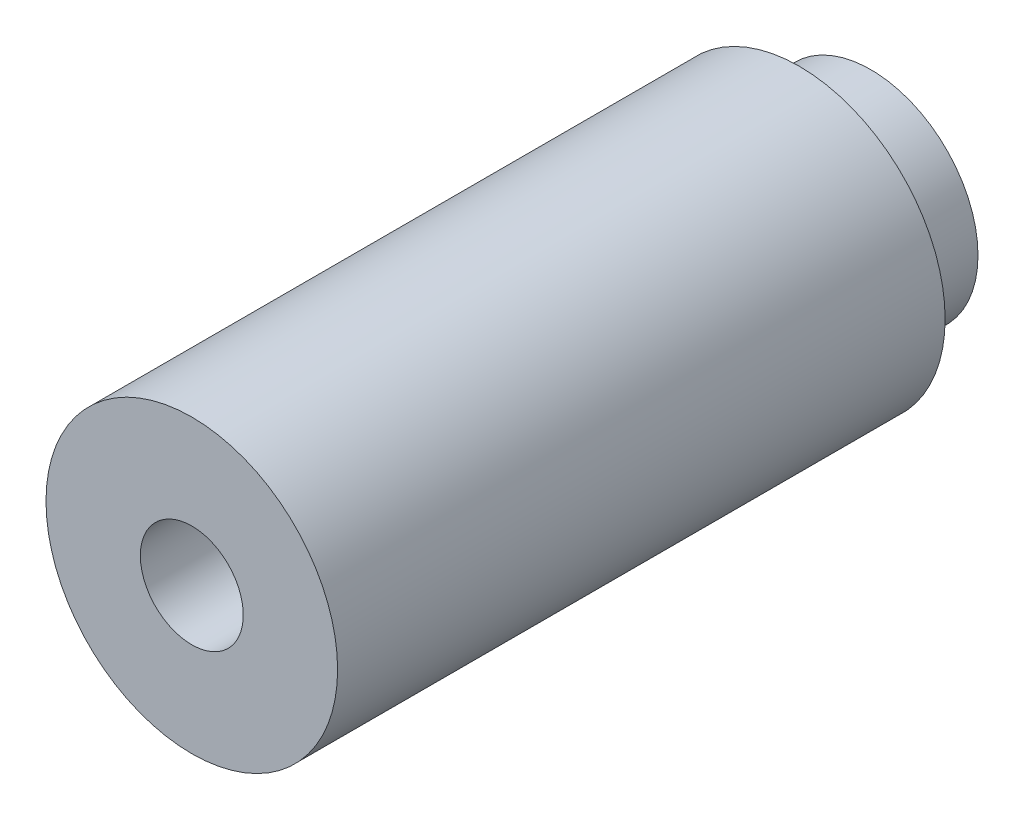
SolidWorks part; units mm, degrees
ref_plane "Front Plane" through (0, 0, 0) normal (0, 0, 1) x (1, 0, 0)
ref_plane "Top Plane" through (0, 0, 0) normal (0, 1, 0) x (1, 0, 0)
ref_plane "Right Plane" through (0, 0, 0) normal (1, 0, 0) x (0, 0, -1)
sketch "Sketch2" plane through (0, 0, 0) normal (0, 0, 1) x (1, 0, 0)
  circle A0 centre (0, 0) radius 12.954
  dimension "D1" = 25.908
extrude "Boss-Extrude1" add sketch "Sketch2" along normal blind 53.975
sketch "Sketch3" plane through (0, 0, 0) normal (0, 0, -1) x (-1, 0, 0)
  circle A0 centre (0, 0) radius 9.525
  dimension "D1" = 19.05
extrude "Boss-Extrude2" add sketch "Sketch3" along normal blind 6.35
sketch "Sketch4" plane through (0, 0, -6.35) normal (0, 0, -1) x (-1, 0, 0)
  circle A0 centre (0, 0) radius 4.572
  dimension "D1" = 9.144
extrude "Cut-Extrude1" cut sketch "Sketch4" against normal through all
